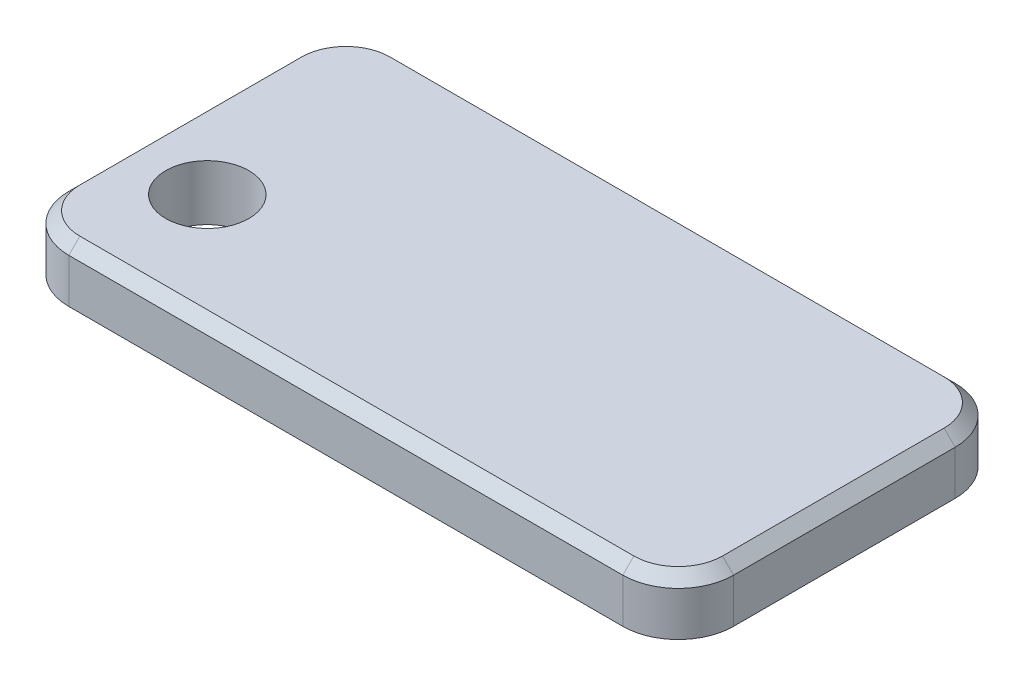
SolidWorks part; units mm, degrees
ref_plane "Front Plane" through (0, 0, 0) normal (0, 0, 1) x (1, 0, 0)
ref_plane "Top Plane" through (0, 0, 0) normal (0, 1, 0) x (1, 0, 0)
ref_plane "Right Plane" through (0, 0, 0) normal (1, 0, 0) x (0, 0, -1)
sketch "Sketch1" plane through (0, 0, 0) normal (0, 1, 0) x (1, 0, 0)
  line L1 (0, 0) -> (152.4, 0)
  line L2 (0, 0) -> (0, 76.2)
  line L3 (0, 76.2) -> (152.4, 76.2)
  line L4 (152.4, 0) -> (152.4, 76.2)
  dimension "D1" = 76.2
  dimension "D2" = 152.4
extrude "Extrude1" add sketch "Sketch1" along normal blind 12.7
sketch "Sketch2" plane through (0, 12.7, 0) normal (0, 1, 0) x (-1, 0, 0)
  line L0 (0, -76.2) -> (0, 0) construction
  line L1 (0, 0) -> (-152.4, 0) construction
  circle A0 centre (-19.05, -25.4) radius 9.525
  dimension "D1" = 19.05
  dimension "D2" = 19.05
  dimension "D3" = 25.4
extrude "Cut-Extrude1" cut sketch "Sketch2" against normal through all
fillet "Fillet1" radius 12.7 4 edges at (0, 6.35, -76.2) (152.4, 6.35, -76.2) (152.4, 6.35, 0) (0, 6.35, 0)
chamfer "Chamfer1" distance 2.54 angle 45 8 edges at (76.2, 12.7, -76.2) (152.4, 12.7, -38.1) (0, 12.7, -38.1) (76.2, 12.7, 0) (3.7197, 12.7, -72.4803) (3.7197, 12.7, -3.7197) (148.6803, 12.7, -3.7197) (148.6803, 12.7, -72.4803)
